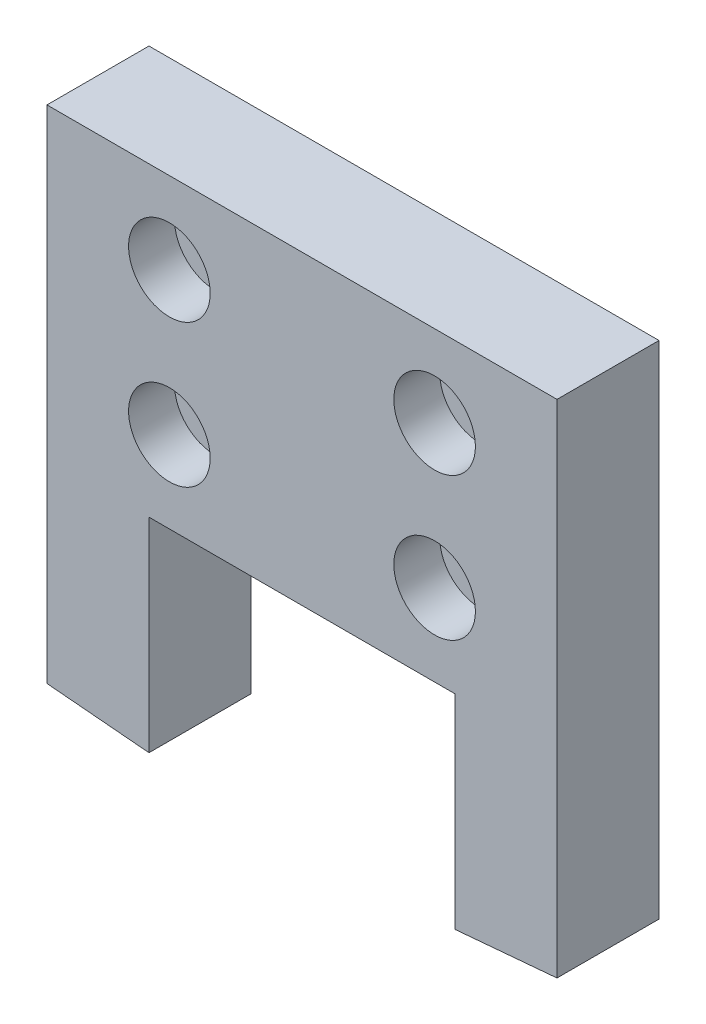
SolidWorks part; units mm, degrees
ref_plane "前视基准面" through (0, 0, 0) normal (0, 0, 1) x (1, 0, 0)
ref_plane "上视基准面" through (0, 0, 0) normal (0, 1, 0) x (1, 0, 0)
ref_plane "右视基准面" through (0, 0, 0) normal (1, 0, 0) x (0, 0, -1)
sketch "草图1" plane through (0, 0, 0) normal (0, 0, 1) x (1, 0, 0)
  line L0 (0, 50) -> (50, 50)
  line L1 (10, 20) -> (40, 20)
  line L2 (0, 0.8749) -> (10, 0)
  line L3 (0, 0.8749) -> (0, 50)
  line L4 (50, 0.8749) -> (50, 50)
  line L5 (10, 0) -> (10, 20)
  line L6 (40, 0) -> (40, 20)
  line L7 (40, 0) -> (50, 0.8749)
  circle A0 centre (12, 42) radius 2.25
  circle A1 centre (38, 42) radius 2.25
  circle A2 centre (38, 28) radius 2.25
  circle A3 centre (12, 28) radius 2.25
extrude "凸台-拉伸1" add sketch "草图1" along normal blind 10
sketch "草图2" plane through (0, 0, 10) normal (0, 0, 1) x (1, 0, 0)
  circle A0 centre (12, 42) radius 4
  circle A1 centre (38, 42) radius 4
  circle A2 centre (38, 28) radius 4
  circle A3 centre (12, 28) radius 4
extrude "切除-拉伸1" cut sketch "草图2" against normal blind 4.5
